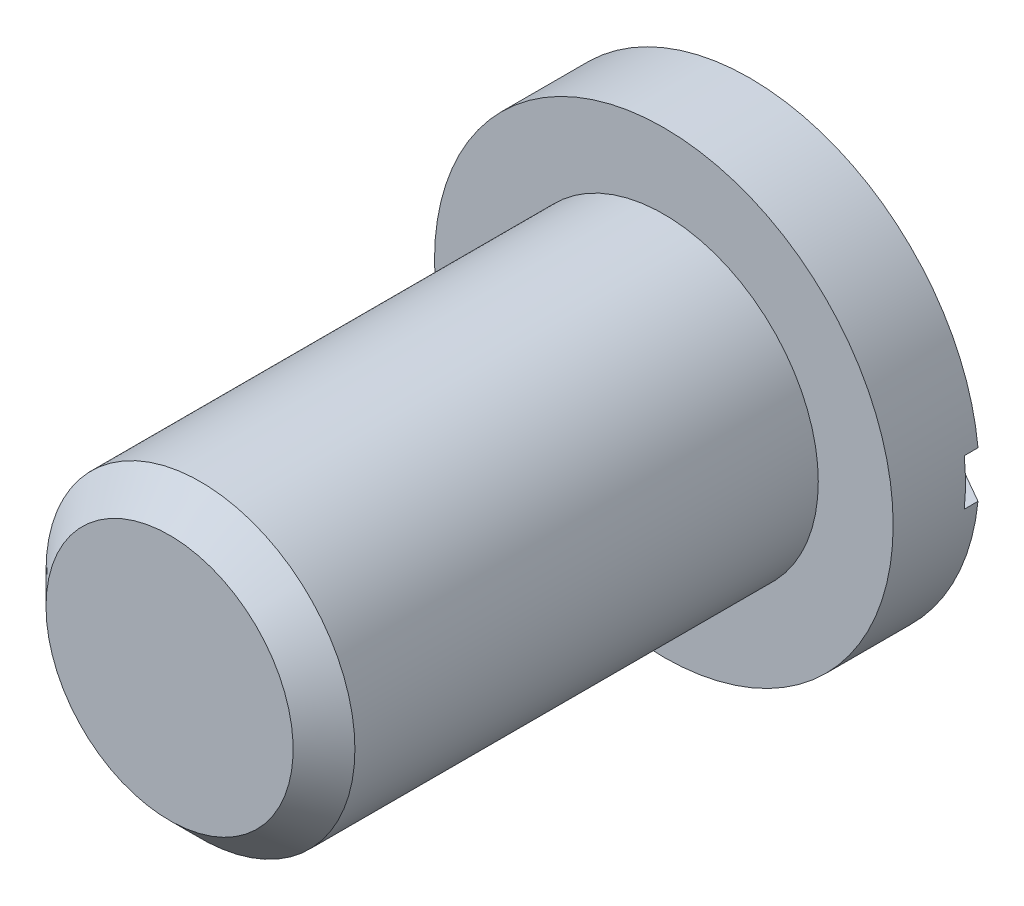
SolidWorks part; units mm, degrees
ref_plane "Спереди" through (0, 0, 0) normal (0, 0, 1) x (1, 0, 0)
ref_plane "Сверху" through (0, 0, 0) normal (0, 1, 0) x (1, 0, 0)
ref_plane "Справа" through (0, 0, 0) normal (1, 0, 0) x (0, 0, -1)
sketch "Эскиз1" plane through (0, 0, 0) normal (1, 0, 0) x (0, 0, -1)
  line L0 (0, 0) -> (-49.1682, 0) construction
  line L1 (0, 0) -> (-15.748, 0)
  line L2 (-15.748, 0) -> (-15.748, 3.175)
  line L3 (-14.9542, 3.9687) -> (-3.048, 3.9687)
  line L4 (-3.048, 3.9687) -> (-3.048, 5.8928)
  line L5 (-3.048, 5.8928) -> (-0.8382, 5.8928)
  line L6 (-0.8382, 5.8928) -> (0, 4.441)
  line L7 (0, 4.441) -> (0, 0)
  line L8 (-15.748, 3.175) -> (-14.9542, 3.9687)
  point P5 (-15.748, 3.9687)
  dimension "D1" = 30
  dimension "D2" = 12.7
  dimension "D3" = 15.748
  dimension "D4" = 7.9375
  dimension "D5" = 2.2098
  dimension "D6" = 11.7856
revolve "Повернуть1" add sketch "Эскиз1" angle 360 about L0
sketch "Эскиз2" plane through (0, 0, 0) normal (1, 0, 0) x (0, 0, -1)
  line L1 (0, 0.5953) -> (-1.1906, 0.5953)
  line L2 (0, 0.5953) -> (0, -0.5953)
  line L3 (0, -0.5953) -> (-1.1906, -0.5953)
  line L4 (-1.1906, 0.5953) -> (-1.1906, -0.5953)
  dimension "D1" = 1.1906
  dimension "D2" = 1.1906
extrude "Вырез-Вытянуть1" cut sketch "Эскиз2" against normal mid plane 12.7
